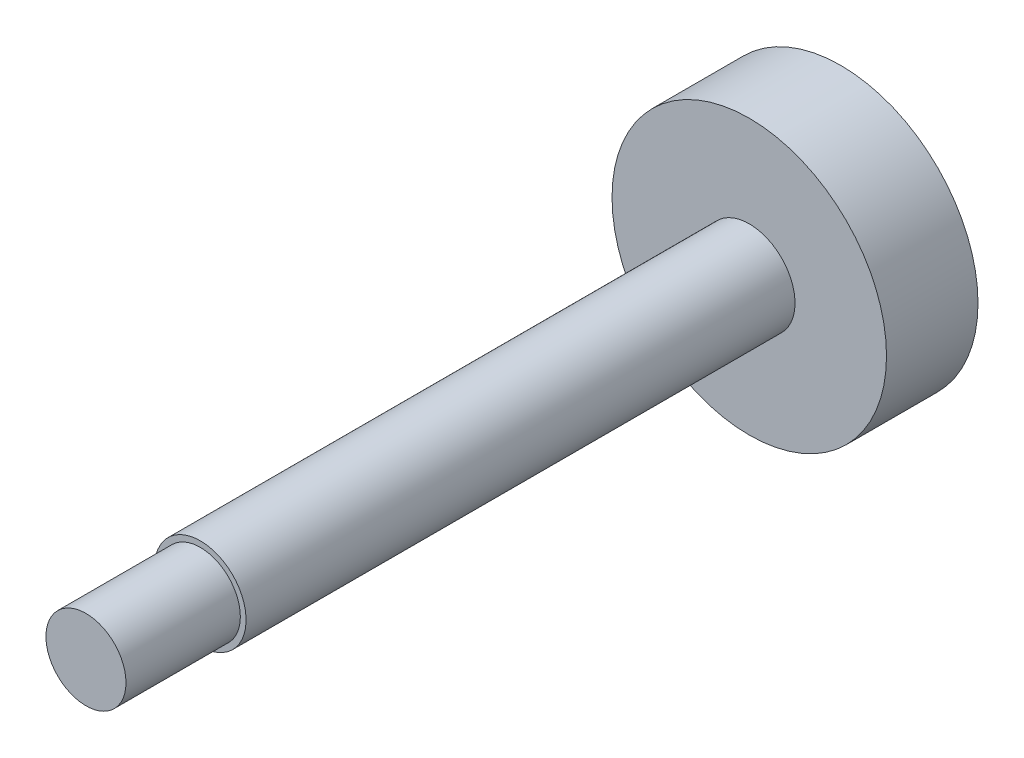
SolidWorks part; units mm, degrees
ref_plane "Front Plane" through (0, 0, 0) normal (0, 0, 1) x (1, 0, 0)
ref_plane "Top Plane" through (0, 0, 0) normal (0, 1, 0) x (1, 0, 0)
ref_plane "Right Plane" through (0, 0, 0) normal (1, 0, 0) x (0, 0, -1)
sketch "Sketch1" plane through (0, 0, 0) normal (0, 0, 1) x (1, 0, 0)
  circle A0 centre (0, 0) radius 38.1
  dimension "D1" = 76.2
extrude "Extrude1" add sketch "Sketch1" along normal blind 25.4
sketch "Sketch2" plane through (0, 0, 25.4) normal (0, 0, 1) x (1, 0, 0)
  circle A0 centre (0, 0) radius 12.7
  dimension "D1" = 25.4
extrude "Extrude2" add sketch "Sketch2" along normal blind 152.4
sketch "Sketch3" plane through (0, 0, 177.8) normal (0, 0, 1) x (1, 0, 0)
  circle A0 centre (0, 0) radius 11.1125
  dimension "D1" = 22.225
extrude "Extrude3" add sketch "Sketch3" along normal blind 31.75
